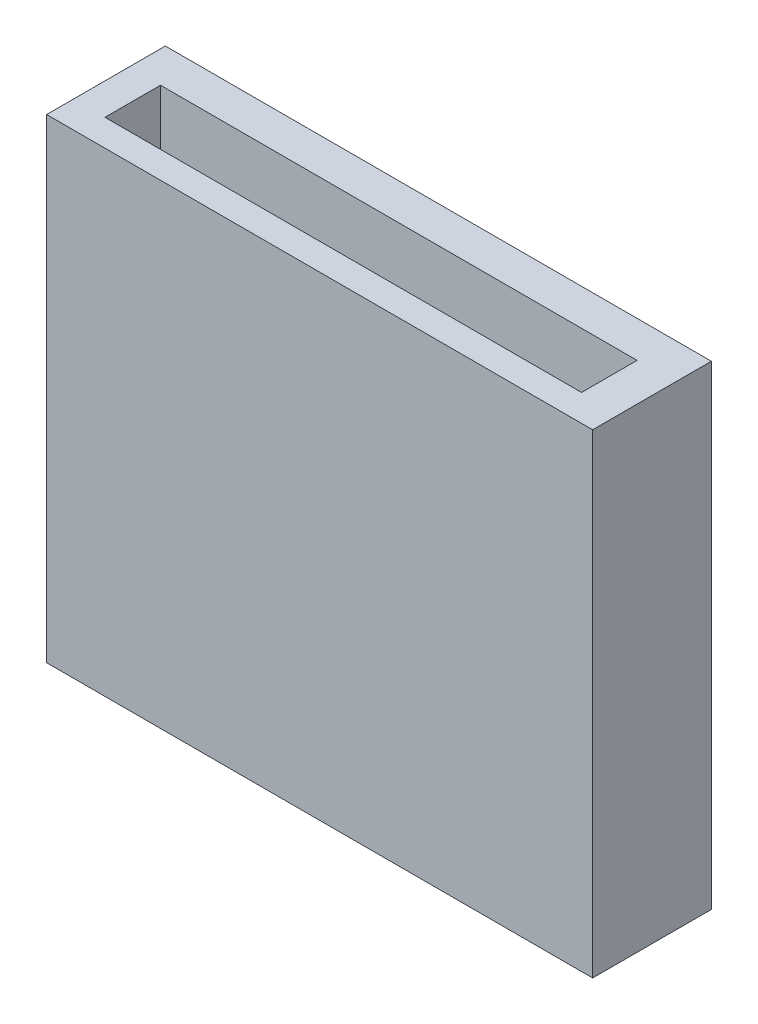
SolidWorks part; units mm, degrees
ref_plane "Front Plane" through (0, 0, 0) normal (0, 0, 1) x (1, 0, 0)
ref_plane "Top Plane" through (0, 0, 0) normal (0, 1, 0) x (1, 0, 0)
ref_plane "Right Plane" through (0, 0, 0) normal (1, 0, 0) x (0, 0, -1)
sketch "Sketch1" plane through (0, 0, 0) normal (0, 1, 0) x (1, 0, 0)
  line L1 (0, 0) -> (46, 0)
  line L2 (0, 0) -> (0, 10)
  line L3 (0, 10) -> (46, 10)
  line L4 (46, 0) -> (46, 10)
extrude "Boss-Extrude1" add sketch "Sketch1" along normal blind 40
sketch "Sketch3" plane through (0, 40, 0) normal (0, 1, 0) x (1, 0, 0)
  line L1 (2.6574, 2.2546) -> (42.8074, 2.2546)
  line L2 (2.6574, 2.2546) -> (2.6574, 6.9346)
  line L3 (2.6574, 6.9346) -> (42.8074, 6.9346)
  line L4 (42.8074, 2.2546) -> (42.8074, 6.9346)
  line L5 (2.6574, 2.2546) -> (42.8074, 6.9346) construction
  line L6 (2.6574, 6.9346) -> (42.8074, 2.2546) construction
  point P0 (22.7324, 4.5946)
  dimension "D1" = 40.15
  dimension "D2" = 4.68
extrude "Cut-Extrude1" cut sketch "Sketch3" against normal up to surface (40 mm away)
